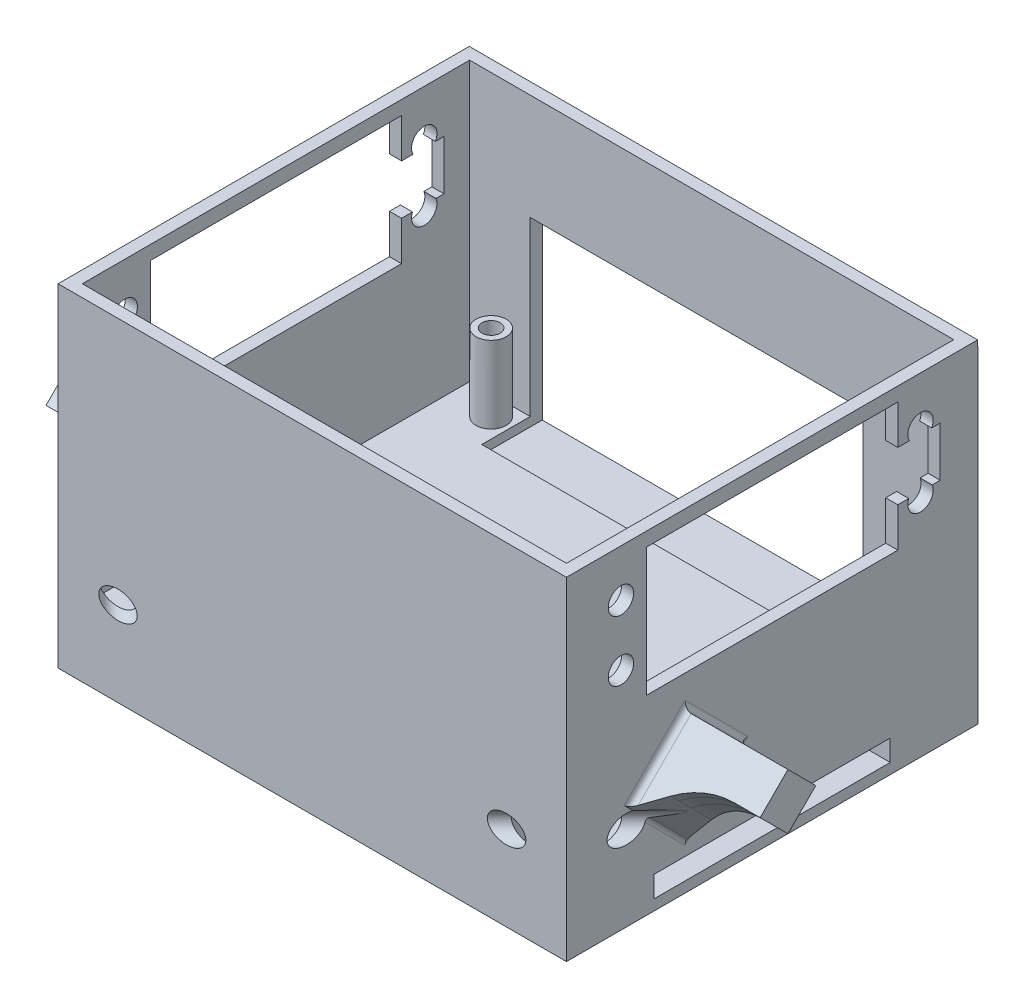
SolidWorks part; units mm, degrees
ref_plane "Front Plane" through (0, 0, 0) normal (0, 0, 1) x (1, 0, 0)
ref_plane "Top Plane" through (0, 0, 0) normal (0, 1, 0) x (1, 0, 0)
ref_plane "Right Plane" through (0, 0, 0) normal (1, 0, 0) x (0, 0, -1)
sketch "Sketch1" plane through (0, 0, 0) normal (0, 1, 0) x (1, 0, 0)
  line L0 (0, 0) -> (80, 0)
  line L1 (80, 0) -> (80, -64)
  line L2 (80, -64) -> (0, -64)
  line L3 (0, -64) -> (0, 0)
  dimension "D1" = 80
  dimension "D2" = 64
extrude "Boss-Extrude1" add sketch "Sketch1" along normal blind 45
shell "Shell1" thickness 2
ref_plane "Plane1" through (0, 0, 0) normal (0, 1, 0) x (1, 0, 0)
sketch "Sketch2" plane through (0, 0, 0) normal (0, 1, 0) x (1, 0, 0)
  line L2 (0, 0) -> (0, -64) construction
  line L3 (80, -64) -> (80, 0) construction
  line L5 (0, -64) -> (80, -64) construction
  circle A2 centre (68.2, -61.6) radius 2
  circle A3 centre (11.8, -61.6) radius 2
  circle A6 centre (68.2, -61.6) radius 1
  circle A7 centre (11.8, -61.6) radius 1
  dimension "D5" = 4
  dimension "D6" = 2
  dimension "D3" = 11.8
  dimension "D4" = 11.8
  dimension "D9" = 2.4
  dimension "D10" = 2.4
extrude "Boss-Extrude2" add sketch "Sketch2" along normal blind 8.7
sketch "Sketch7" plane through (0, 0, 0) normal (0, 1, 0) x (1, 0, 0)
  line L0 (80, 0) -> (0, 0) construction
  line L1 (80, 0) -> (0, 0) construction
  line L2 (0, 0) -> (0, -64) construction
  line L3 (80, -64) -> (80, 0) construction
  circle A0 centre (6.8, -3.25) radius 1.5
  circle A1 centre (6.8, -3.25) radius 2.5
  circle A2 centre (73.2, -3.25) radius 1.5
  circle A3 centre (73.2, -3.25) radius 2.5
  dimension "D1" = 5
  dimension "D2" = 3
  dimension "D3" = 3.25
  dimension "D4" = 3.25
  dimension "D5" = 6.8
  dimension "D6" = 6.8
extrude "Boss-Extrude3" add sketch "Sketch7" along normal blind 12.7
ref_plane "Plane3" through (0, 45, 0) normal (0, 1, 0) x (1, 0, 0)
ref_plane "Plane4" through (0, 14.4, 0) normal (0, 1, 0) x (1, 0, 0)
ref_plane "Plane5" through (0, 0, -2) normal (0, 0, -1) x (-1, 0, 0)
sketch "Sketch10" plane through (0, 0, -2) normal (0, 0, -1) x (-1, 0, 0)
  line L0 (-82, 45) -> (-82, -2) construction
  line L1 (-82, -2) -> (2, -2) construction
  line L2 (2, 45) -> (2, -2) construction
  circle A0 centre (-15.5, 17) radius 3
  circle A1 centre (-50.75, 17) radius 3
  dimension "D1" = 6
  dimension "D2" = 31.25
  dimension "D3" = 19
  dimension "D4" = 19
  dimension "D5" = 17.5
extrude "Cut-Extrude3" cut sketch "Sketch10" against normal blind 10
ref_plane "Plane6" through (82, 0, 0) normal (1, 0, 0) x (0, 0, -1)
sketch "Sketch11" plane through (82, 0, 0) normal (1, 0, 0) x (0, 0, -1)
  line L4 (-52.75, 22.5) -> (-52.75, 43.7)
  line L5 (-52.75, 43.7) -> (-11.25, 43.7)
  line L6 (-11.25, 43.7) -> (-11.25, 37.2)
  line L7 (-11.25, 37.2) -> (-4.25, 37.2)
  line L8 (-4.25, 37.2) -> (-4.25, 29)
  line L9 (-4.25, 29) -> (-11.25, 29)
  line L10 (-11.25, 29) -> (-11.25, 22.5)
  line L11 (-11.25, 22.5) -> (-52.75, 22.5)
  line L12 (-66, -2) -> (2, -2) construction
  line L13 (-66, 45) -> (-66, -2) construction
  line L14 (-52.75, 33.1) -> (-66, 33.1) construction
  line L15 (-11.25, 37.2) -> (-11.25, 29) construction
  line L16 (-11.25, 33.1) -> (2, 33.1) construction
  line L17 (2, -25.85) -> (2, 25.85) construction
  dimension "D1" = 41.5
  dimension "D2" = 21.2
  dimension "D3" = 6.5
  dimension "D4" = 24.5
  dimension "D5" = 7
extrude "Cut-Extrude4" cut sketch "Sketch11" against normal through all
ref_plane "Plane7" through (8, 0, -8) normal (0.7071, 0, -0.7071) x (-0.7071, 0, -0.7071)
ref_plane "Plane8" through (50.4264, 0, -50.4264) normal (0.7071, 0, -0.7071) x (-0.7071, 0, -0.7071)
sketch "Sketch12" plane through (50.4264, 0, -50.4264) normal (0.7071, 0, -0.7071) x (-0.7071, 0, -0.7071)
  line L0 (-104.6518, -2) -> (-56.5685, -2) construction
  line L1 (-104.6518, 45) -> (-104.6518, -2) construction
  circle A0 centre (-97.6518, 5) radius 2.25
  dimension "D3" = 4.5
  dimension "D1" = 7
  dimension "D2" = 7
extrude "Cut-Extrude5" cut sketch "Sketch12" against normal through all
ref_plane "Plane9" through (32, 0, 32) normal (0.7071, 0, 0.7071) x (0.7071, 0, -0.7071)
ref_plane "Plane10" through (-10.4264, 0, -10.4264) normal (-0.7071, 0, -0.7071) x (-0.7071, 0, 0.7071)
sketch "Sketch14" plane through (-10.4264, 0, -10.4264) normal (-0.7071, 0, -0.7071) x (-0.7071, 0, 0.7071)
  line L0 (48.0833, 45) -> (48.0833, -2) construction
  line L1 (0, -2) -> (48.0833, -2) construction
  circle A0 centre (41.0833, 5) radius 2.25
  dimension "D3" = 4.5
  dimension "D1" = 7
  dimension "D2" = 7
extrude "Cut-Extrude6" cut sketch "Sketch14" against normal through all
ref_plane "Plane11" through (-2, 0, 0) normal (-1, 0, 0) x (0, 0, 1)
sketch "Sketch15" plane through (-2, 0, 0) normal (-1, 0, 0) x (0, 0, 1)
  line L0 (46.4038, 17.1924) -> (41.8076, 12.5962)
  line L1 (41.8076, 12.5962) -> (46.4038, 8)
  line L2 (46.4038, 8) -> (51, 12.5962)
  line L3 (51, 12.5962) -> (46.4038, 17.1924)
  line L4 (66, 45) -> (66, -2) construction
  line L5 (-2, -2) -> (66, -2) construction
  line L6 (46.4038, 17.1924) -> (46.4038, 8) construction
  dimension "D1" = 6.5
  dimension "D2" = 15
  dimension "D3" = 10
extrude "Boss-Extrude4" add sketch "Sketch15" along normal blind 17
sketch "Sketch16" plane through (82, 0, 0) normal (1, 0, 0) x (0, 0, -1)
  line L0 (-46.4038, 17.1924) -> (-51, 12.5962)
  line L1 (-51, 12.5962) -> (-46.4038, 8)
  line L2 (-46.4038, 8) -> (-41.8076, 12.5962)
  line L3 (-41.8076, 12.5962) -> (-46.4038, 17.1924)
  line L4 (-46.4038, 17.1924) -> (-46.4038, 8) construction
  line L5 (-66, -2) -> (2, -2) construction
  line L6 (-66, 45) -> (-66, -2) construction
  dimension "D1" = 6.5
  dimension "D2" = 10
  dimension "D3" = 15
extrude "Boss-Extrude5" add sketch "Sketch16" along normal blind 17
chamfer "Chamfer1" distance 8 angle 40 4 edges at (82, 10.2981, 48.7019) (82, 10.2981, 44.1057) (-2, 10.2981, 44.1057) (-2, 10.2981, 48.7019)
ref_plane "Plane12" through (0, -25.2123, 25.2123) normal (0, -0.7071, 0.7071) x (1, 0, 0)
sketch "Sketch18" plane through (0, -25.2123, 25.2123) normal (0, -0.7071, 0.7071) x (1, 0, 0)
  line L0 (-19, 38.4693) -> (-19, 44.9693) construction
  line L1 (99, 44.9693) -> (99, 38.4693) construction
  line L4 (-16.5, 41.7193) -> (-16.5, 44.9693) construction
  line L5 (-19, 44.9693) -> (-10, 44.9693) construction
  line L6 (-16.5, 41.7193) -> (-16.5, 38.4693) construction
  line L8 (-19, 38.4693) -> (-10, 38.4693) construction
  line L9 (96.5, 41.7193) -> (96.5, 44.9693) construction
  line L10 (99, 44.9693) -> (90, 44.9693) construction
  line L11 (96.5, 41.7193) -> (96.5, 38.4693) construction
  line L12 (99, 38.4693) -> (90, 38.4693) construction
  circle A0 centre (96.5, 41.7193) radius 2.25
  circle A1 centre (-16.5, 41.7193) radius 2.25
  dimension "D1" = 4.5
  dimension "D2" = 2.5
  dimension "D3" = 2.5
extrude "Cut-Extrude7" cut sketch "Sketch18" against normal offset from surface (13.5 mm away) 1.5
sketch "Sketch19" plane through (0, -25.2123, 25.2123) normal (0, -0.7071, 0.7071) x (1, 0, 0)
  circle A0 centre (96.5, 41.7193) radius 0.5
  circle A1 centre (-16.5, 41.7193) radius 0.5
  dimension "D1" = 1
extrude "Cut-Extrude8" cut sketch "Sketch19" against normal through all
fillet "Fillet4" radius 13 4 edges at (-10, 10.2981, 44.1057) (-10, 10.2981, 48.7019) (90, 10.2981, 44.1057) (90, 10.2981, 48.7019)
fillet "Fillet1" radius 1 2 edges at (-16.5, 14.5407, 43.7522) (96.5, 14.5407, 43.7522)
ref_plane "Plane13" through (0, -2, 0) normal (0, -1, 0) x (-1, 0, 0)
sketch "Sketch20" plane through (0, -2, 0) normal (0, -1, 0) x (-1, 0, 0)
  line L0 (10.2787, 26.2787) -> (-26.2787, -10.2787) construction
  line L1 (-82, -66) -> (2, -66)
  line L2 (-82, -66) -> (-82, 2)
  line L3 (-82, 2) -> (2, 2)
  line L4 (2, -66) -> (2, 2)
  line L5 (2, -66) -> (-82, -66) construction
  line L6 (2, -25.85) -> (2, 25.85) construction
  line L7 (25.85, 2) -> (-25.85, 2) construction
extrude "Boss-Extrude6" add sketch "Sketch20" along normal blind 7
sketch "Sketch21" plane through (82, 0, 0) normal (1, 0, 0) x (0, 0, -1)
  line L0 (2, -9) -> (-66, -9) construction
  line L1 (-51.5, -7.25) -> (-12.5, -7.25)
  line L2 (-51.5, -7.25) -> (-51.5, -3.75)
  line L3 (-51.5, -3.75) -> (-12.5, -3.75)
  line L4 (-12.5, -7.25) -> (-12.5, -3.75)
  line L5 (-51.5, -5.5) -> (-66, -5.5) construction
  line L6 (-66, 45) -> (-66, -9) construction
  line L7 (-12.5, -5.5) -> (2, -5.5) construction
  line L8 (2, -25.85) -> (2, 25.85) construction
  dimension "D1" = 39
  dimension "D2" = 3.5
  dimension "D3" = 1.75
extrude "Cut-Extrude9" cut sketch "Sketch21" against normal through all
sketch "Sketch22" plane through (0, 45, 0) normal (0, 1, 0) x (1, 0, 0)
  line L0 (-2, 25.85) -> (-2, -25.85) construction
  line L1 (-2, -66) -> (82, -66)
  line L2 (-2, -66) -> (-2, 1.9366)
  line L3 (-2, 1.9366) -> (82, 1.9366)
  line L4 (82, -66) -> (82, 1.9366)
  line L5 (-2, -66) -> (82, -66) construction
  line L6 (82, -25.85) -> (82, 25.85) construction
  line L7 (13.7213, -50.2787) -> (50.2787, -13.7213) construction
  line L8 (0, -64) -> (80, -64)
  line L9 (0, -64) -> (0, 0)
  line L10 (0, 0) -> (80, 0)
  line L11 (80, -64) -> (80, 0)
  line L12 (0, -64) -> (80, -64) construction
extrude "Boss-Extrude7" add sketch "Sketch22" along normal blind 1
sketch "Sketch23" plane through (0, 0, -2) normal (0, 0, -1) x (-1, 0, 0)
  line L0 (2, -9) -> (-82, -9) construction
  line L1 (-45.5, -1) -> (-34.5, -1)
  line L2 (-45.5, -1) -> (-45.5, 7)
  line L3 (-45.5, 7) -> (-34.5, 7)
  line L4 (-34.5, -1) -> (-34.5, 7)
  line L5 (-45.5, 1.6) -> (-34.5, 1.6) construction
  line L6 (-45.5, 4.4) -> (-34.5, 4.4) construction
  line L7 (-81, -9) -> (-81, 0) construction
  line L8 (-81, 0) -> (-51, 0) construction
  line L9 (-51, 0) -> (-51, -9) construction
  line L10 (-82, 25.85) -> (-82, -25.85) construction
  line L11 (-45.5, 3) -> (-82, 3) construction
  line L12 (-34.5, 3) -> (2, 3) construction
  line L13 (2, -25.85) -> (2, 25.85) construction
  dimension "D1" = 11
  dimension "D2" = 8
  dimension "D3" = 8
  dimension "D4" = 2.6
  dimension "D5" = 2.6
  dimension "D6" = 30
  dimension "D7" = 9
  dimension "D9" = 1
extrude "Cut-Extrude10" cut sketch "Sketch23" against normal blind 2
fillet "Fillet2" radius 1 8 edges at (-2, 12.521, 51.0752) (-2, 12.521, 41.7324) (82, 12.521, 41.7324) (82, 12.521, 51.0752) (82, 3.701, 58.6986) (82, 3.1781, 41.7324) (-2, 3.1781, 41.7324) (85.7165, 6.299, 49.7859)
fillet "Fillet3" radius 0.5 4 edges at (40, 7, -2) (45.5, 3, -2) (40, -1, -2) (34.5, 3, -2)
sketch "Sketch24" plane through (82, 0, 0) normal (1, 0, 0) x (0, 0, -1)
  line L1 (-11.25, 43.7) -> (-52.75, 43.7) construction
  line L3 (-52.75, 43.7) -> (-52.75, 22.5) construction
  circle A0 centre (-57, 38.2) radius 2.1
  circle A1 centre (-57, 28.2) radius 2.1
  circle A2 centre (-7.5, 28.2) radius 2.1
  circle A3 centre (-7.5, 38.2) radius 2.1
  point P10 (-57.5488, 28.4734)
  dimension "D1" = 4.2
  dimension "D2" = 4.2
  dimension "D3" = 4.2
  dimension "D4" = 4.2
  dimension "D5" = 49.5
  dimension "D6" = 49.5
  dimension "D7" = 10
  dimension "D8" = 5.5
  dimension "D9" = 4.25
  dimension "D10" = 4.25
  dimension "D11" = 10
  dimension "D12" = 5.5
extrude "Cut-Extrude11" cut sketch "Sketch24" against normal through all
sketch "Sketch25" plane through (0, 0, -2) normal (0, 0, -1) x (-1, 0, 0)
  line L0 (2, -9) -> (-82, -9) construction
  line L1 (-65, 28.5) -> (-10, 28.5)
  line L2 (-65, 28.5) -> (-65, -1.5)
  line L3 (-65, -1.5) -> (-10, -1.5)
  line L4 (-10, 28.5) -> (-10, -1.5)
  line L5 (2, 45) -> (2, -9) construction
  dimension "D1" = 55
  dimension "D2" = 30
  dimension "D3" = 7.5
  dimension "D4" = 12
extrude "Cut-Extrude12" cut sketch "Sketch25" against normal blind 10
